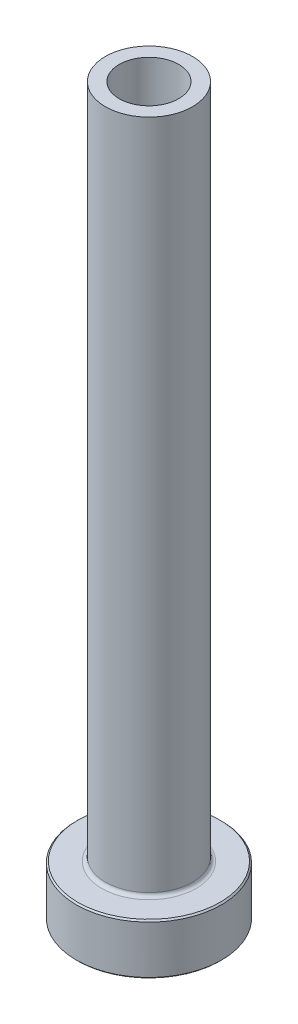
SolidWorks part; units mm, degrees
ref_plane "Front Plane" through (0, 0, 0) normal (0, 0, 1) x (1, 0, 0)
ref_plane "Top Plane" through (0, 0, 0) normal (0, 1, 0) x (1, 0, 0)
ref_plane "Right Plane" through (0, 0, 0) normal (1, 0, 0) x (0, 0, -1)
sketch "Sketch1" plane through (0, 0, 0) normal (0, 0, 1) x (1, 0, 0)
  line L0 (-4.1, 100) -> (-6, 100)
  line L1 (-6, 100) -> (-6, 7)
  line L2 (-6, 7) -> (-10, 7)
  line L3 (-10, 7) -> (-10, 0)
  line L4 (8.8, 0) -> (-8.8, 0) construction
  line L5 (-10, 0) -> (-4.35, 0)
  line L6 (-4.1, 55) -> (-4.1, 100)
  line L7 (0, 92.1877) -> (0, -15.5353) construction
  line L8 (0, -8.8) -> (0, 8.8) construction
  line L9 (-4.1, 55) -> (-4.35, 43)
  line L10 (-4.35, 43) -> (-4.35, 0)
  dimension "D1" = 0.25
  dimension "ID" = 8.2
  dimension "OD" = 12
  dimension "L" = 100
  dimension "H" = 20
  dimension "T" = 7
  dimension "N" = 45
  dimension "D2" = 12
revolve "Revolve1" add sketch "Sketch1" angle 360 about L7
fillet "Fillet1" radius 0.5 1 edges at (0, 7, 6)
chamfer "Chamfer1" distance 0.2 angle 45 2 edges at (0, 7, 10) (0, 0, 10)
chamfer "Chamfer3" distance 0.5 angle 45 1 edges at (0, 0, 4.35)
